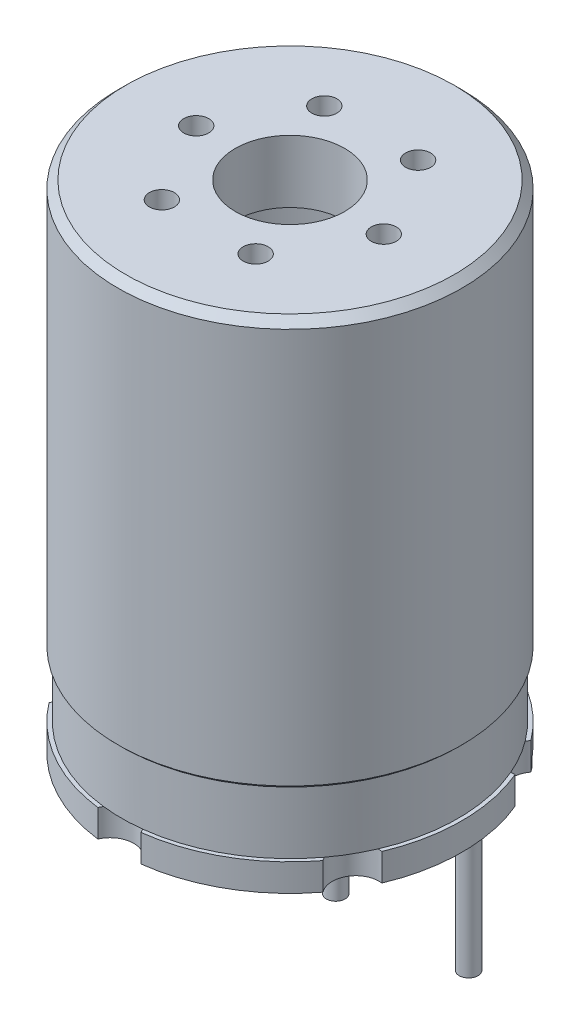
SolidWorks part; units mm, degrees
other "<ALD_M840029__P_Portescap_22NT_82_213P>-<Extrusion26>"
other "<Pièce2>-<Chanfrein1>"
ref_plane "Dessus" through (0, 0, 0) normal (0, 0, 1) x (1, 0, 0)
ref_plane "Droite" through (0, 0, 0) normal (0, 1, 0) x (1, 0, 0)
ref_plane "Face" through (0, 0, 0) normal (1, 0, 0) x (0, 0, -1)
imported_body "Importée1"
imported_body "Importée2"
sketch "Esquisse1" plane through (0, 0, 0) normal (1, 0, 0) x (0, 0, -1)
  line L0 (0, -12.761) -> (0, 56.8815) construction
  line L1 (-8, 26) -> (-3.5, 26)
  line L2 (-8, 26) -> (-8, 6)
  line L3 (-8, 6) -> (-6, 6)
  line L4 (0, 40) -> (0, 1)
  line L5 (0, 50) -> (0, -50) construction
  line L6 (10.5, 30) -> (-10.5, 30) construction
  line L7 (-6, 6) -> (-6, 1)
  line L8 (-6, 1) -> (0, 1)
  line L9 (-3.5, 26) -> (-3.5, 40)
  line L10 (-3.5, 40) -> (0, 40)
  dimension "D1" = 4
  dimension "D2" = 16
  dimension "D3" = 20
  dimension "D4" = 12
  dimension "D5" = 5
  dimension "D6" = 10
  dimension "D7" = 7
revolve "Enlèvement de matière-Révolution1" cut sketch "Esquisse1" angle 360 about L0
